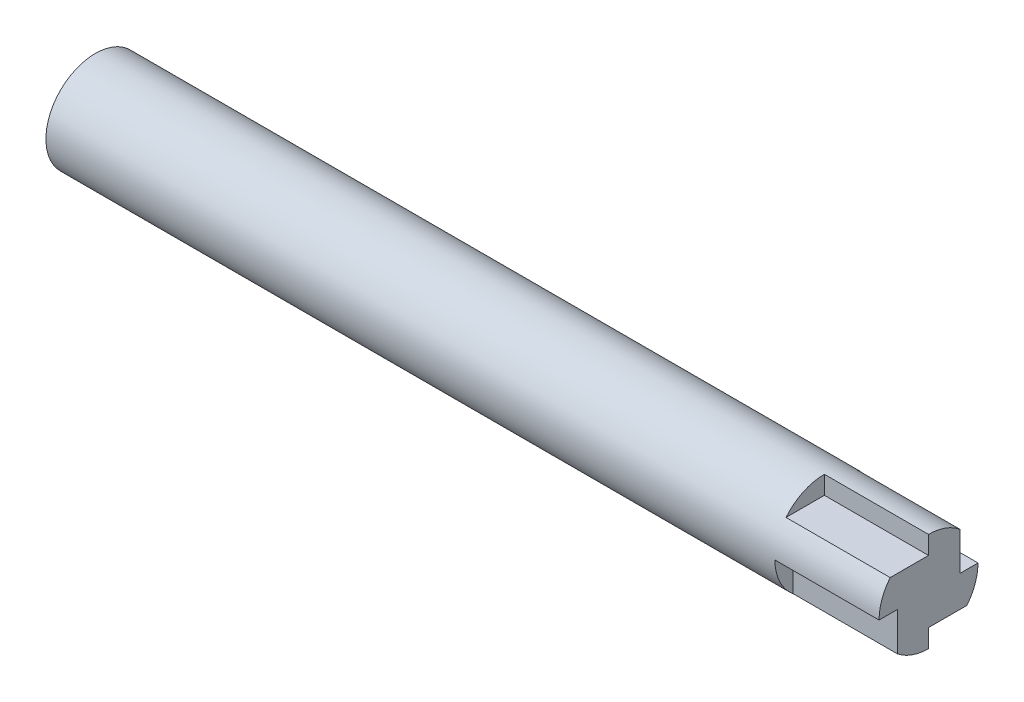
SolidWorks part; units mm, degrees
ref_plane "Front Plane" through (0, 0, 0) normal (0, 0, 1) x (1, 0, 0)
ref_plane "Top Plane" through (0, 0, 0) normal (0, 1, 0) x (1, 0, 0)
ref_plane "Right Plane" through (0, 0, 0) normal (1, 0, 0) x (0, 0, -1)
sketch "Sketch1" plane through (0, 0, 0) normal (1, 0, 0) x (0, 0, -1)
  circle A0 centre (0, 0) radius 12.065
  dimension "D1" = 24.13
extrude "Boss-Extrude1" add sketch "Sketch1" along normal blind 203.2
sketch "Sketch2" plane through (203.2, 0, 0) normal (1, 0, 0) x (0, 0, -1)
  line L3 (-9.3541, 7.62) -> (0, 7.62)
  line L4 (0, 12.065) -> (0, 7.62)
  arc A0 (0, 12.065) -> (-9.3541, 7.62) centre (0, 0) ccw
  circle A1 centre (0, 0) radius 12.065 construction
  dimension "D1" = 7.62
extrude "Cut-Extrude1" cut sketch "Sketch2" against normal blind 25.4
pattern_circular "CirPattern1" count 4 over 360 about axis through (0, 0, 0) along (1, 0, 0) of "Cut-Extrude1"
